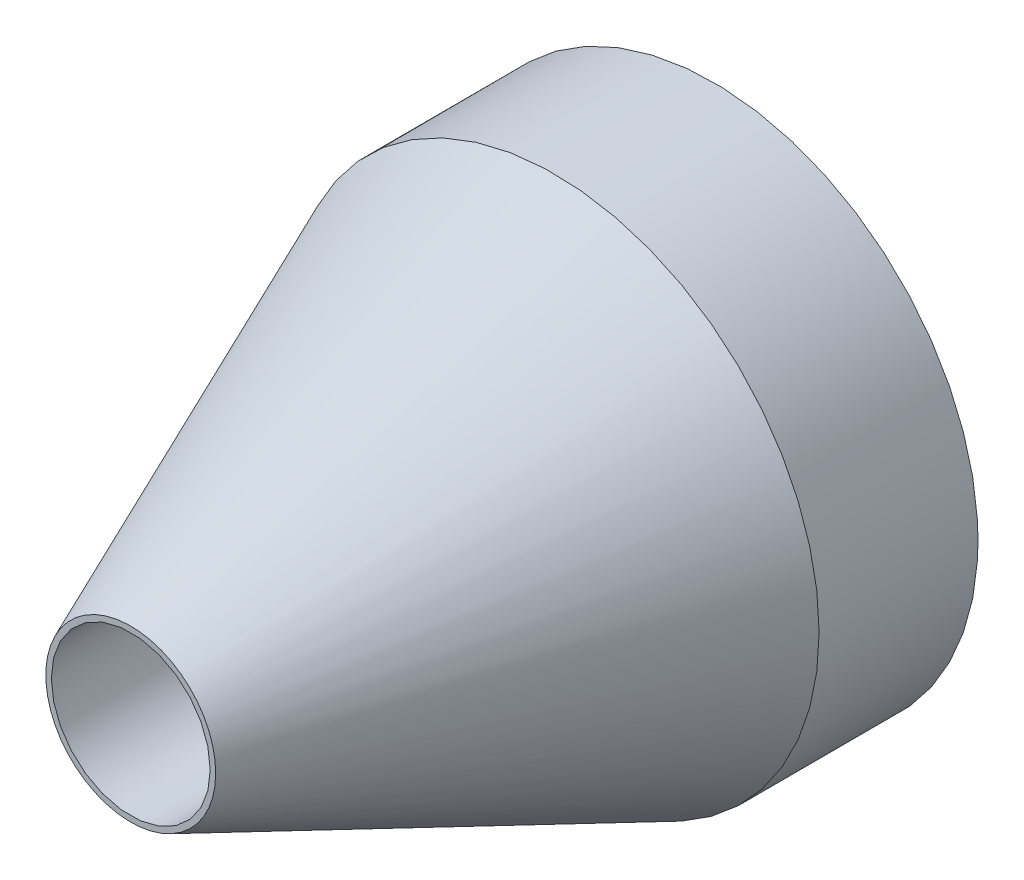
SolidWorks part; units mm, degrees
ref_plane "Plan de face" through (0, 0, 0) normal (0, 0, 1) x (1, 0, 0)
ref_plane "Plan de dessus" through (0, 0, 0) normal (0, 1, 0) x (1, 0, 0)
ref_plane "Plan de droite" through (0, 0, 0) normal (1, 0, 0) x (0, 0, -1)
sketch "Esquisse1" plane through (0, 0, 0) normal (0, 0, 1) x (1, 0, 0)
  circle A0 centre (0, 0) radius 25
  dimension "D1" = 50
extrude "Boss.-Extru.1" add sketch "Esquisse1" along normal blind 15
sketch "Esquisse2" plane through (0, 0, 15) normal (0, 0, 1) x (1, 0, 0)
  circle A0 centre (0, 0) radius 25
extrude "Boss.-Extru.2" add sketch "Esquisse2" along normal blind 40 draft 23
sketch "Esquisse3" plane through (0, 0, 0) normal (0, 0, -1) x (-1, 0, 0)
  circle A0 centre (0, 0) radius 19.75
  dimension "D1" = 39.5
extrude "Enlèv. mat.-Extru.1" cut sketch "Esquisse3" against normal blind 15
sketch "Esquisse4" plane through (0, 0, 15) normal (0, 0, -1) x (-1, 0, 0)
  circle A0 centre (0, 0) radius 19.75
  dimension "D1" = 39.5
extrude "Enlèv. mat.-Extru.2" cut sketch "Esquisse4" against normal blind 45 draft 25
sketch "Esquisse5" plane through (0, 0, 55) normal (0, 0, 1) x (1, 0, 0)
  circle A0 centre (0, 0) radius 7.5
  dimension "D1" = 15
extrude "Enlèv. mat.-Extru.3" cut sketch "Esquisse5" against normal blind 45
chamfer "Chanfrein1" distance 1.5 angle 45 1 edges at (-19.75, 0, 0)
thread "Filetage1" pitch 2.1167 start angle 0, offset 32, length 0, pitch 2.31, diameter 39.5
ref_plane "Plan2" through (19.75, 0, -30.5) normal (0, -1, 0) x (1, 0, 0)
sketch "Profil de filetage2" plane through (19.75, 0, -30.5) normal (0, -1, 0) x (1, 0, 0)
  line L0 (0, 0) -> (0, 2.1167) construction
  line L1 (0, 0) -> (1.1457, 0.6615)
  line L2 (1.1457, 0.6615) -> (1.1457, 0.926)
  line L3 (1.1457, 0.926) -> (0, 1.5875)
  line L4 (1.1457, 0.7937) -> (0, 0.7937) construction
  line L11 (0, 0) -> (0, 1.5875)
  point P2 (0, 0)
  dimension "Pitch" = 2.1167
  dimension "Profile_Angle" = 60
  dimension "Profile_Land" = 0.2646
  dimension "Profile_Height" = 1.1457
equation "\"çà\"=0"
